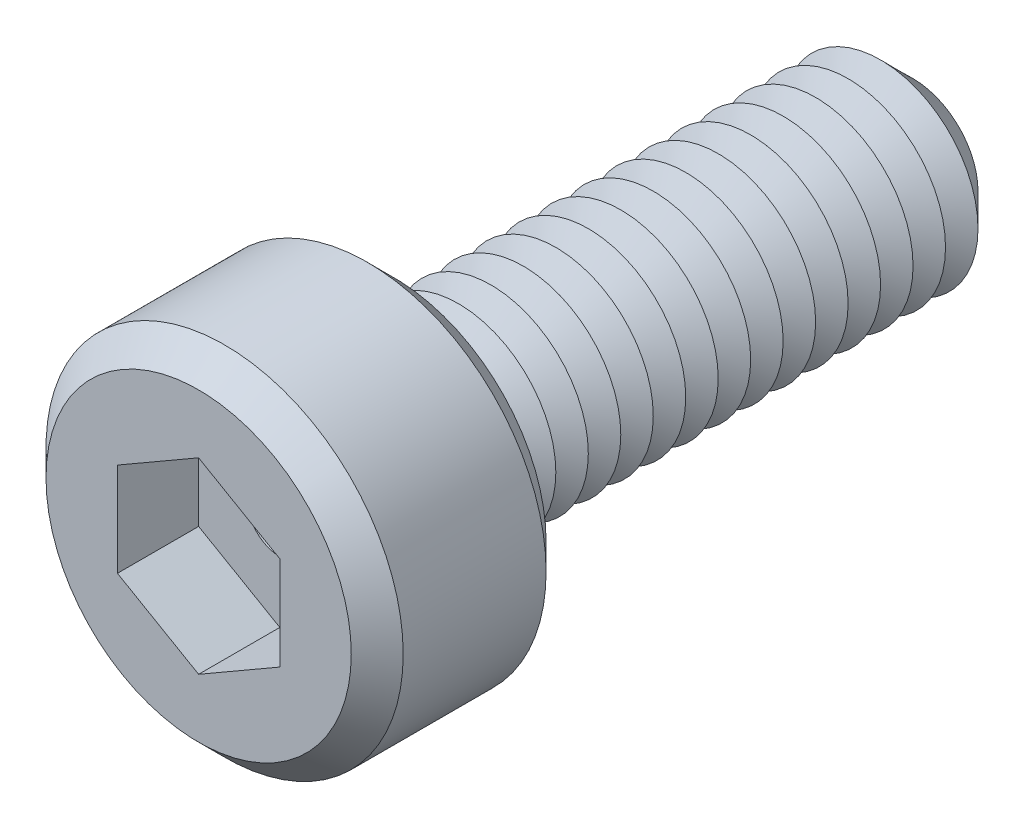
SolidWorks part; units mm, degrees
ref_plane "Front Plane" through (0, 0, 0) normal (0, 0, 1) x (1, 0, 0)
ref_plane "Top Plane" through (0, 0, 0) normal (0, 1, 0) x (1, 0, 0)
ref_plane "Right Plane" through (0, 0, 0) normal (1, 0, 0) x (0, 0, -1)
sketch "Sketch1" plane through (0, 0, 0) normal (0, 0, 1) x (1, 0, 0)
  circle A0 centre (0, 0) radius 2.75
  dimension "D1" = 5.5
extrude "Boss-Extrude1" add sketch "Sketch1" along normal blind 3
sketch "Sketch2" plane through (0, 0, 0) normal (0, 0, -1) x (-1, 0, 0)
  circle A0 centre (0, 0) radius 1.5
  dimension "D1" = 3
extrude "Boss-Extrude2" add sketch "Sketch2" along normal blind 8
chamfer "Chamfer1" distance 0.5 angle 45 1 edges at (-1.5, 0, -8)
sketch "Sketch3" plane through (0, 0, 0) normal (1, 0, 0) x (0, 0, -1)
  line L0 (-2.5121, 0) -> (4.5776, 0) construction
sketch "Sketch4" plane through (0, 0, 0) normal (1, 0, 0) x (0, 0, -1)
  line L0 (0, 1.5) -> (0.25, 1.067)
  line L1 (0.25, 1.067) -> (0.5, 1.5)
  line L2 (7.5, 1.5) -> (0, 1.5) construction
  line L3 (0.5, 1.5) -> (0, 1.5)
  dimension "D1" = 0.5
revolve "Cut-Revolve1" cut sketch "Sketch4" angle 360 about L0
pattern_linear "LPattern1" count 15 spacing 0.5 along (0, 0, -1) of "Cut-Revolve1"
sketch "Sketch5" plane through (0, 0, 3) normal (0, 0, 1) x (1, 0, 0)
  line L1 (0, 1.4434) -> (-1.25, 0.7217)
  line L2 (-1.25, 0.7217) -> (-1.25, -0.7217)
  line L3 (-1.25, -0.7217) -> (0, -1.4434)
  line L4 (0, -1.4434) -> (1.25, -0.7217)
  line L5 (1.25, -0.7217) -> (1.25, 0.7217)
  line L6 (1.25, 0.7217) -> (0, 1.4434)
  circle A0 centre (0, 0) radius 1.25 construction
  dimension "D1" = 2.5
extrude "Cut-Extrude1" cut sketch "Sketch5" against normal blind 1.25
sketch "Sketch6" plane through (0, 0, 1.75) normal (0, 0, 1) x (1, 0, 0)
  circle A0 centre (0, 0) radius 0.5
  dimension "D1" = 1
extrude "Cut-Extrude2" cut sketch "Sketch6" against normal up to surface (9.75 mm away)
chamfer "Chamfer2" distance 0.4 angle 45 2 edges at (2.75, 0, 0) (2.75, 0, 3)
